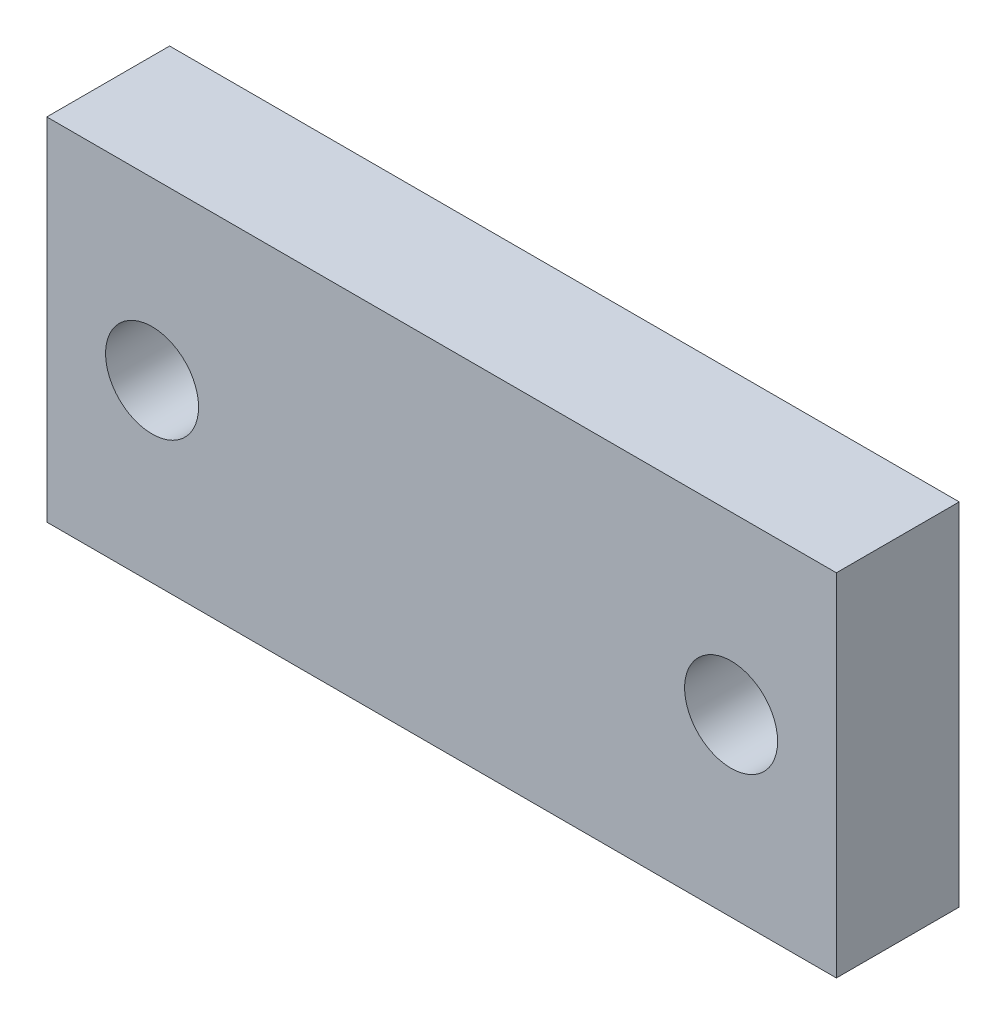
SolidWorks part; units mm, degrees
ref_plane "Plan de face" through (0, 0, 0) normal (0, 0, 1) x (1, 0, 0)
ref_plane "Plan de dessus" through (0, 0, 0) normal (0, 1, 0) x (1, 0, 0)
ref_plane "Plan de droite" through (0, 0, 0) normal (1, 0, 0) x (0, 0, -1)
sketch "Esquisse1" plane through (0, 0, 0) normal (0, 0, 1) x (1, 0, 0)
  line L1 (0, 0) -> (45, 0)
  line L2 (0, 0) -> (0, -20)
  line L3 (0, -20) -> (45, -20)
  line L4 (45, 0) -> (45, -20)
  dimension "D1" = 45
  dimension "D2" = 20
extrude "Boss.-Extru.1" add sketch "Esquisse1" along normal blind 7
sketch "Esquisse2" plane through (0, 0, 7) normal (0, 0, 1) x (1, 0, 0)
  line L1 (45, -20) -> (45, 0) construction
  line L2 (45, 0) -> (0, 0) construction
  line L3 (0, 0) -> (0, -20) construction
  circle A0 centre (6, -10) radius 2.65
  circle A1 centre (39, -10) radius 2.65
  point P8 (0, 0)
  dimension "D1" = 5.3
  dimension "D2" = 6
  dimension "D3" = 10
  dimension "D4" = 6
extrude "Enlèv. mat.-Extru.1" cut sketch "Esquisse2" against normal blind 7
